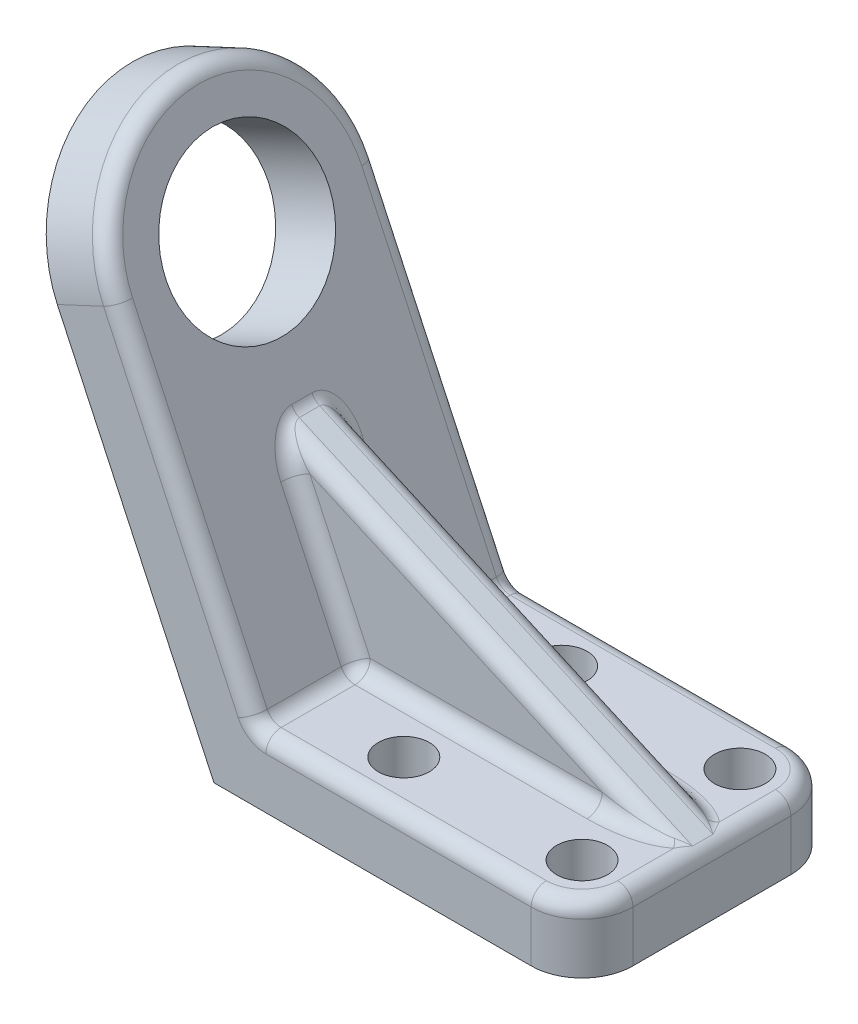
SolidWorks part; units mm, degrees
ref_plane "Front" through (0, 0, 0) normal (0, 0, 1) x (1, 0, 0)
ref_plane "Top" through (0, 0, 0) normal (0, 1, 0) x (1, 0, 0)
ref_plane "Right" through (0, 0, 0) normal (1, 0, 0) x (0, 0, -1)
sketch "Sketch1" plane through (0, 0, 0) normal (0, 0, 1) x (1, 0, 0)
  line L0 (0, 0) -> (128, 0)
  line L1 (0, 0) -> (-76.0713, 163.1354)
  dimension "D1" = 65
  dimension "D2" = 128
  dimension "D3" = 180
extrude "Base-Extrude-Thin" add sketch "Sketch1" along normal mid plane 102 thin
sketch "Sketch7" plane through (0, 0, 0) normal (0, 0, 1) x (1, 0, 0)
  line L6 (0, 0) -> (-76.0713, 163.1354)
  line L7 (-76.0713, 163.1354) -> (-99.6353, 152.1473)
  line L8 (-99.6353, 152.1473) -> (-16.5638, -26)
  line L9 (-16.5638, -26) -> (128, -26)
  line L10 (128, -26) -> (128, 0)
  line L11 (128, 0) -> (0, 0)
  line L12 (0, 0) -> (-76.0713, 163.1354)
  line L13 (-76.0713, 163.1354) -> (-99.6353, 152.1473)
  line L14 (-99.6353, 152.1473) -> (-16.5638, -26)
  line L15 (-16.5638, -26) -> (128, -26)
  line L16 (128, -26) -> (128, 0)
  line L17 (128, 0) -> (0, 0)
  dimension "D1" = 0
sketch "Sketch4" plane through (0, 0, 0) normal (0.9063, 0.4226, 0) x (0, 0, -1)
  line L0 (-51, 0) -> (-51, 180) construction
  line L1 (51, 0) -> (51, 180) construction
  line L3 (-51, 129) -> (51, 129) construction
  line L4 (-51, 180) -> (51, 180) construction
  arc A0 (-51, 129) -> (51, 129) centre (0, 129) cw
extrude "Cut-Extrude1" cut sketch "Sketch4" against normal through all
sketch "Sketch5" plane through (0, 0, 0) normal (0.9063, 0.4226, 0) x (0, 0, -1)
  circle A0 centre (0, 129) radius 32
  dimension "D1" = 64
extrude "Cut-Extrude2" cut sketch "Sketch5" against normal through all
fillet "Fillet4" radius 20 2 edges at (128, -13, 51) (128, -13, -51)
fillet "Fillet7" radius 6 1 edges at (0, 0, 0)
sketch "Sketch6" plane through (0, 0, 0) normal (0, 1, 0) x (-1, 0, 0)
  circle A0 centre (-108, 31) radius 10
  circle A1 centre (-108, -31) radius 10
  arc A2 (-128, -31) -> (-108, -51) centre (-108, -31) ccw construction
  arc A3 (-108, 51) -> (-128, 31) centre (-108, 31) ccw construction
  dimension "D1" = 20
extrude "Cut-Extrude3" cut sketch "Sketch6" against normal through all
pattern_linear "LPattern1" count 2 spacing 70 along (-1, 0, 0) of "Cut-Extrude3"
fillet "Fillet3" radius 6 10 edges at (-76.0713, 163.1354, 0) (128, 0, 0) (55.9112, 0, 51) (55.9112, 0, -51) (122.1421, 0, -45.1421) (122.1421, 0, 45.1421) (-28.0666, 60.189, 51) (-28.0666, 60.189, -51) (0.5986, 0.9397, -51) (0.5986, 0.9397, 51)
sketch "Sketch2" plane through (0, 0, 0) normal (0, 0, 1) x (1, 0, 0)
  line L0 (124.4315, -0.5147) -> (-32.119, 68.8794)
  line L2 (-54.5178, 116.9137) -> (-1.6154, 3.4643) construction
  arc A0 (128, -6) -> (122, 0) centre (122, -6) ccw construction
  dimension "D1" = 76
rib "Rib2" sketch "Sketch2" sketch "Sketch2" thickness 20 extrusion direction parallel to sketch draft on no parameters "D1"=20
fillet "Fillet5" radius 6 4 edges at (123.2427, -0.1301, -10) (123.2427, -0.1301, 10) (46.1562, 34.1823, -10) (46.1562, 34.1823, 10)
fillet "Fillet6" radius 6 13 edges at (0.5986, 0.9397, -10) (-14.9383, 32.0353, -10) (0.5986, 0.9397, 10) (-14.9383, 32.0353, 10) (-32.119, 68.8794, 0) (56.1433, 0, -10) (56.1433, 0, 10) (-30.9891, 66.4563, -8.2426) (116.5383, 0, -9.0293) (123.2427, -0.1301, -5.2427) (-30.9891, 66.4563, 8.2426) (123.2427, -0.1301, 5.2427) (116.5383, 0, 9.0293)
